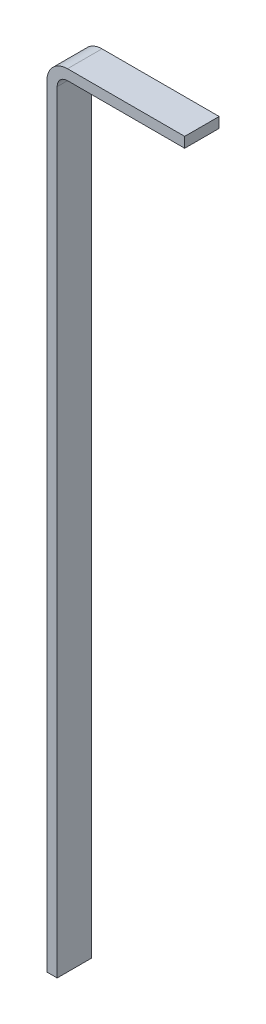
SolidWorks part; units mm, degrees
ref_plane "Plan de face" through (0, 0, 0) normal (0, 0, 1) x (1, 0, 0)
ref_plane "Plan de dessus" through (0, 0, 0) normal (0, 1, 0) x (1, 0, 0)
ref_plane "Plan de droite" through (0, 0, 0) normal (1, 0, 0) x (0, 0, -1)
sketch "Esquisse1" plane through (0, 0, 0) normal (0, 0, 1) x (1, 0, 0)
  line L0 (68, 12) -> (0, 12)
  line L1 (-12, 0) -> (-12, -448)
  line L2 (-12, -448) -> (-6, -448)
  line L3 (-6, -448) -> (-6, 0)
  line L4 (0, 6) -> (68, 6)
  line L5 (68, 12) -> (68, 6)
  arc A0 (0, 12) -> (-12, 0) centre (0, 0) ccw
  arc A1 (-6, 0) -> (0, 6) centre (0, 0) cw
  dimension "D3" = 12
  dimension "D4" = 6
  dimension "D1" = 6
  dimension "D2" = 6
  dimension "D5" = 80
  dimension "D6" = 460
extrude "Boss.-Extru.1" add sketch "Esquisse1" along normal blind 20
